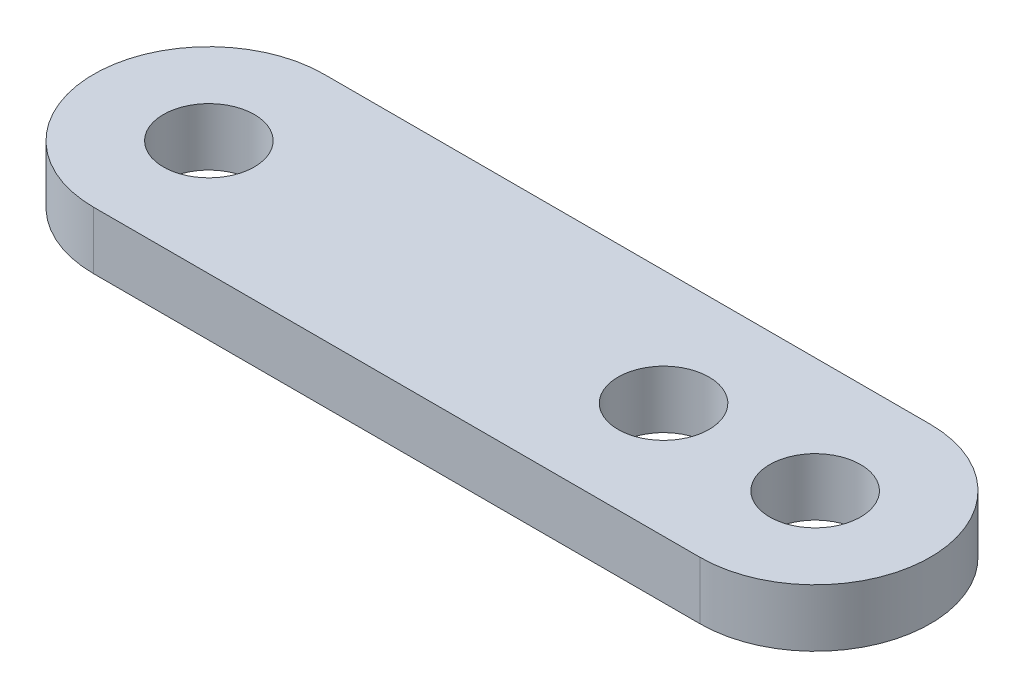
SolidWorks part; units mm, degrees
ref_plane "Front Plane" through (0, 0, 0) normal (0, 0, 1) x (1, 0, 0)
ref_plane "Top Plane" through (0, 0, 0) normal (0, 1, 0) x (1, 0, 0)
ref_plane "Right Plane" through (0, 0, 0) normal (1, 0, 0) x (0, 0, -1)
sketch "Sketch1" plane through (0, 0, 0) normal (0, 1, 0) x (1, 0, 0)
  line L1 (10, -3.8) -> (-10, -3.8)
  line L2 (10, -3.8) -> (10, 3.8)
  line L3 (10, 3.8) -> (-10, 3.8)
  line L4 (-10, -3.8) -> (-10, 3.8)
  line L5 (10, -3.8) -> (-10, 3.8) construction
  line L6 (10, 3.8) -> (-10, -3.8) construction
  circle A0 centre (10, 0) radius 3.8
  circle A1 centre (-10, 0) radius 3.8
  circle A2 centre (-10, 0) radius 1.5
  circle A3 centre (10, 0) radius 1.5
  circle A4 centre (5, 0) radius 1.5
  point P0 (0, 0)
  dimension "D3" = 3
  dimension "D4" = 3
  dimension "D1" = 20
  dimension "D2" = 7.6
  dimension "D5" = 2
extrude "Boss-Extrude1" add sketch "Sketch1" along normal blind 1.9 contours A2 L4 A1 | A2 L4 A1 | A1 L1 A0 L3 | A3 L2 A0 | A3 L2 A0
